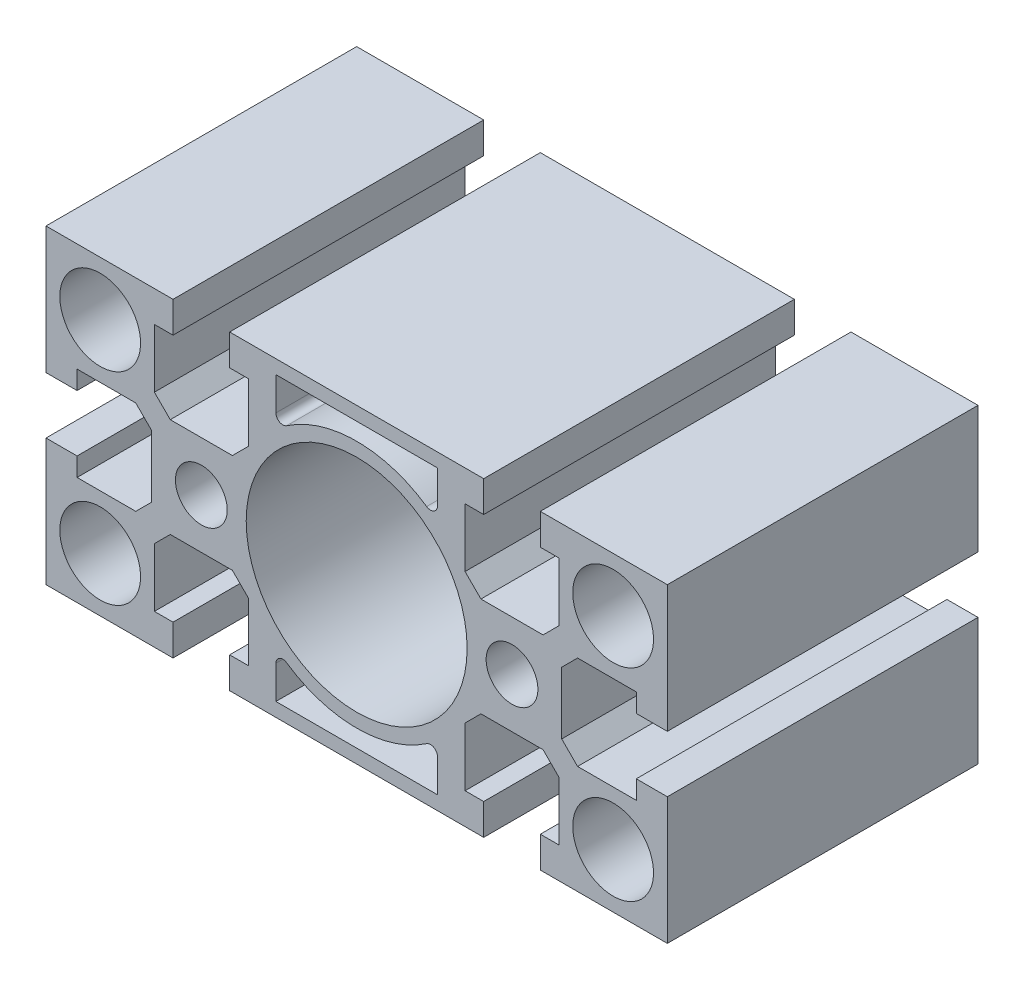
SolidWorks part; units mm, degrees
ref_plane "Front Plane" through (0, 0, 0) normal (0, 0, 1) x (1, 0, 0)
ref_plane "Top Plane" through (0, 0, 0) normal (0, 1, 0) x (1, 0, 0)
ref_plane "Right Plane" through (0, 0, 0) normal (1, 0, 0) x (0, 0, -1)
sketch "Sketch1" plane through (0, 0, 0) normal (0, 0, 1) x (1, 0, 0)
  line L3 (11.7, 20.5) -> (11.7, 15.7006)
  line L4 (-11.7, 20.5) -> (11.7, 20.5)
  line L5 (-11.7, 15.7006) -> (-11.7, 20.5)
  line L9 (11.7, -15.7006) -> (11.7, -20.5)
  line L10 (-11.7, -20.5) -> (-11.7, -15.7006)
  line L11 (11.7, -20.5) -> (-11.7, -20.5)
  line L128 (40.5, 6.8) -> (40.5, 4.1)
  line L129 (40.5, 4.1) -> (45, 4.1)
  line L130 (45, 4.1) -> (45, 22.5)
  line L131 (45, 22.5) -> (26.6, 22.5)
  line L132 (26.6, 22.5) -> (26.6, 18)
  line L133 (26.6, 18) -> (29.3, 18)
  line L134 (29.3, 18) -> (29.3, 9.5)
  line L135 (29.3, 9.5) -> (27, 7.2)
  line L136 (27, 7.2) -> (18, 7.2)
  line L137 (18, 7.2) -> (15.7, 9.5)
  line L138 (15.7, 9.5) -> (15.7, 18)
  line L139 (15.7, 18) -> (18.4, 18)
  line L140 (18.4, 18) -> (18.4, 22.5)
  line L141 (18.4, 22.5) -> (-18.4, 22.5)
  line L142 (-18.4, 22.5) -> (-18.4, 18)
  line L143 (-18.4, 18) -> (-15.7, 18)
  line L144 (-15.7, 18) -> (-15.7, 9.5)
  line L145 (-15.7, 9.5) -> (-18, 7.2)
  line L146 (-18, 7.2) -> (-27, 7.2)
  line L147 (-27, 7.2) -> (-29.3, 9.5)
  line L148 (-29.3, 9.5) -> (-29.3, 18)
  line L149 (-29.3, 18) -> (-26.6, 18)
  line L150 (-26.6, 18) -> (-26.6, 22.5)
  line L151 (-26.6, 22.5) -> (-45, 22.5)
  line L152 (-45, 22.5) -> (-45, 4.1)
  line L153 (-45, 4.1) -> (-40.5, 4.1)
  line L154 (-40.5, 4.1) -> (-40.5, 6.8)
  line L155 (-40.5, 6.8) -> (-32, 6.8)
  line L156 (-32, 6.8) -> (-29.7, 4.5)
  line L157 (-29.7, 4.5) -> (-29.7, -4.5)
  line L158 (-29.7, -4.5) -> (-32, -6.8)
  line L159 (-32, -6.8) -> (-40.5, -6.8)
  line L160 (-40.5, -6.8) -> (-40.5, -4.1)
  line L161 (-40.5, -4.1) -> (-45, -4.1)
  line L162 (-45, -4.1) -> (-45, -22.5)
  line L163 (-45, -22.5) -> (-26.6, -22.5)
  line L164 (-26.6, -22.5) -> (-26.6, -18)
  line L165 (-26.6, -18) -> (-29.3, -18)
  line L166 (-29.3, -18) -> (-29.3, -9.5)
  line L167 (-29.3, -9.5) -> (-27, -7.2)
  line L168 (-27, -7.2) -> (-18, -7.2)
  line L169 (-18, -7.2) -> (-15.7, -9.5)
  line L170 (-15.7, -9.5) -> (-15.7, -18)
  line L171 (-15.7, -18) -> (-18.4, -18)
  line L172 (-18.4, -18) -> (-18.4, -22.5)
  line L173 (-18.4, -22.5) -> (18.4, -22.5)
  line L174 (18.4, -22.5) -> (18.4, -18)
  line L175 (18.4, -18) -> (15.7, -18)
  line L176 (15.7, -18) -> (15.7, -9.5)
  line L177 (15.7, -9.5) -> (18, -7.2)
  line L178 (18, -7.2) -> (27, -7.2)
  line L179 (27, -7.2) -> (29.3, -9.5)
  line L180 (29.3, -9.5) -> (29.3, -18)
  line L181 (29.3, -18) -> (26.6, -18)
  line L182 (26.6, -18) -> (26.6, -22.5)
  line L183 (26.6, -22.5) -> (45, -22.5)
  line L184 (45, -22.5) -> (45, -4.1)
  line L185 (45, -4.1) -> (40.5, -4.1)
  line L186 (40.5, -4.1) -> (40.5, -6.8)
  line L187 (40.5, -6.8) -> (32, -6.8)
  line L188 (32, -6.8) -> (29.7, -4.5)
  line L189 (29.7, -4.5) -> (29.7, 4.5)
  line L190 (29.7, 4.5) -> (32, 6.8)
  line L191 (32, 6.8) -> (40.5, 6.8)
  circle A4 centre (37.15, 14.65) radius 5.85
  circle A5 centre (37.15, -14.65) radius 5.85
  circle A6 centre (-37.15, -14.65) radius 5.85
  circle A7 centre (-37.15, 14.65) radius 5.85
  arc A11 (-11.7, 15.7006) -> (-10.1368, 14.8743) centre (-10.7, 15.7006) ccw
  arc A12 (10.1368, 14.8743) -> (-10.1368, 14.8743) centre (0, 0) ccw
  arc A13 (10.1368, 14.8743) -> (11.7, 15.7006) centre (10.7, 15.7006) ccw
  circle A15 centre (0, 0) radius 16
  circle A18 centre (-22.5, 0) radius 3.75
  circle A19 centre (22.5, 0) radius 3.75
  arc A23 (11.7, -15.7006) -> (10.1368, -14.8743) centre (10.7, -15.7006) ccw
  arc A24 (-10.1368, -14.8743) -> (10.1368, -14.8743) centre (0, 0) ccw
  arc A25 (-10.1368, -14.8743) -> (-11.7, -15.7006) centre (-10.7, -15.7006) ccw
extrude "Extrude1" add sketch "Sketch1" along normal blind 45
sketch "Sketch2" plane through (45, 0, 0) normal (1, 0, 0) x (0, 0, -1)
  line L0 (-45, 22.5) -> (0, 22.5) construction
  line L1 (-45, 4.1) -> (-45, 22.5) construction
  point P0 (-22.5, 0)
  dimension "D1" = 22.5
  dimension "D2" = 22.5
hole_wizard "Ø15.0 (15) Diameter Hole1" positions "3DSketch1" profile "Sketch3" hole size "Ø15.0" standard "Ansi Metric"
sketch3d "3DSketch1"
  point P0 (45, 0, 22.5)
sketch "Sketch3" plane through (45, 0, 22.5) normal (0, 1, 0) x (0, 0, -1)
  line L0 (0, 0) -> (0, 40.5635)
  line L1 (0, 40.5635) -> (4.1, 38.1)
  line L2 (4.1, 38.1) -> (4.1, 0)
  line L5 (4.1, 0) -> (0, 0)
  line L10 (0, 40.5635) -> (-4.1, 38.1) construction
  line L11 (0, -6.35) -> (0, 107.95) construction
  dimension "Hole Dia." = 8.2
  dimension "Hole Depth" = 38.1
  dimension "Drill Angle" = 118
